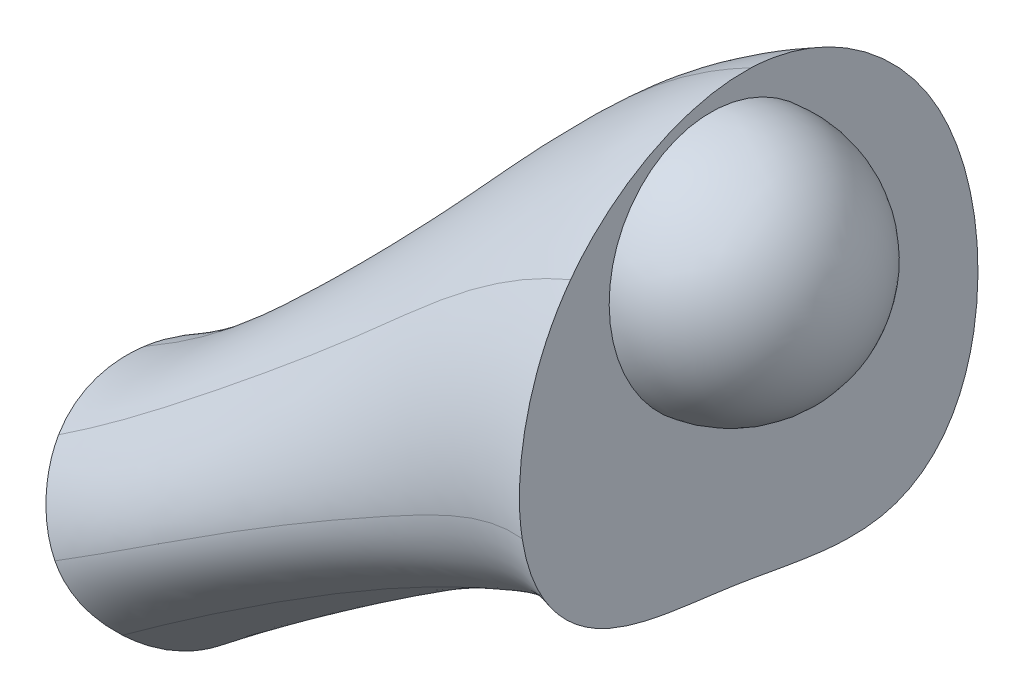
SolidWorks part; units mm, degrees
ref_plane "Front Plane" through (0, 0, 0) normal (0, 0, 1) x (1, 0, 0)
ref_plane "Top Plane" through (0, 0, 0) normal (0, 1, 0) x (1, 0, 0)
ref_plane "Right Plane" through (0, 0, 0) normal (1, 0, 0) x (0, 0, -1)
imported_body "Stock-Source-1"
ref_plane "Plane1" through (0, 0, 76.2) normal (0, 0, 1) x (1, 0, 0)
sketch "Sketch1" plane through (0, 0, 76.2) normal (0, 0, 1) x (1, 0, 0)
  line L0 (-184.2003, 4078.4663) -> (-197.3096, 4157.3951)
  line L1 (-193.7398, 4135.9024) -> (-198.1899, 4162.6953) construction
  arc A0 (-197.3096, 4157.3951) -> (-184.2003, 4078.4663) centre (-190.7549, 4117.9307) cw
  dimension "D1" = 80.01
revolve "Revolve1" add sketch "Sketch1" angle 360 about L0
ref_plane "Plane2" through (0, 0, 81.28) normal (0, 0, 1) x (1, 0, 0)
sketch "Sketch2" plane through (0, 0, 81.28) normal (0, 0, 1) x (1, 0, 0)
  line L0 (-374.8791, 3977.51) -> (-362.0144, 3955.6089)
  line L1 (-374.8791, 3977.51) -> (-396.7802, 3964.6453)
  line L2 (-362.0144, 3955.6089) -> (-383.9155, 3942.7442)
  line L3 (-396.7802, 3964.6453) -> (-383.9155, 3942.7442)
  line L4 (-381.5255, 3988.8249) -> (-368.2327, 3966.1951) construction
  line L5 (-368.2327, 3966.1951) -> (-356.0567, 3945.4664) construction
  dimension "D1" = 25.4
  dimension "D2" = 25.4
revolve "Revolve2" add sketch "Sketch2" angle 360 about L0
